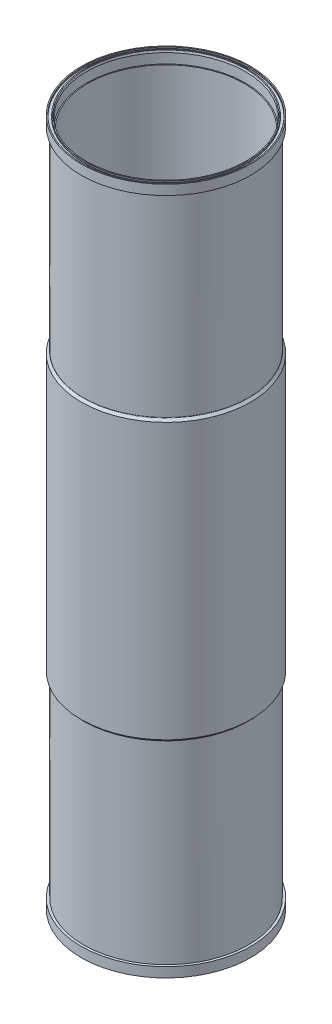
SolidWorks part; units mm, degrees
other "Static 2D"
ref_plane "Front Plane" through (0, 0, 0) normal (0, 0, 1) x (1, 0, 0)
ref_plane "Top Plane" through (0, 0, 0) normal (0, 1, 0) x (1, 0, 0)
ref_plane "Right Plane" through (0, 0, 0) normal (1, 0, 0) x (0, 0, -1)
ref_axis "Axis1" through (0, 880.11, 0) along (0, -1, 0)
sketch "Sketch1" plane through (0, 0, 0) normal (0, 0, 1) x (1, 0, 0)
  line L0 (0, 0) -> (0, 324.6281) construction
  line L1 (-109.5375, 889) -> (-103.3093, 889)
  line L2 (-102.6287, 886.46) -> (-102.6287, 873.76)
  line L3 (-109.5375, 0) -> (-103.3093, 0)
  line L4 (-101.3587, 873.76) -> (-101.3587, 15.24)
  line L5 (-109.5375, 889) -> (-109.5375, 0)
  line L6 (-102.6287, 873.76) -> (-101.3587, 873.76)
  line L7 (-102.6287, 2.54) -> (-102.6287, 15.24)
  line L8 (-102.6287, 15.24) -> (-101.3587, 15.24)
  line L9 (-103.3093, 889) -> (-102.6287, 886.46)
  line L10 (-109.5375, 0) -> (-119.5862, 0) construction
  line L11 (-103.3093, 0) -> (-102.6287, 2.54)
  dimension "D1" = 202.7174
  dimension "D2" = 219.075
  dimension "D3" = 15.24
  dimension "D4" = 15.24
  dimension "D5" = 15
  dimension "D6" = 889
  dimension "D7" = 15
  dimension "D8" = 2.54
  dimension "D9" = 2.54
  dimension "D10" = 205.2574
  dimension "D11" = 8.1788
revolve "Revolve1" add sketch "Sketch1" angle 360 about L0
sketch "Sketch4" plane through (0, 0, 0) normal (0, 0, 1) x (1, 0, 0)
  line L1 (-109.5375, 876.3) -> (-106.4387, 876.3)
  line L2 (-109.5375, 876.3) -> (-109.5375, 12.7)
  line L3 (-109.5375, 12.7) -> (-106.4387, 12.7)
  line L4 (-106.4387, 876.3) -> (-106.4387, 12.7)
  line L5 (-109.5375, 889) -> (-103.3093, 889) construction
  line L6 (-109.5375, 889) -> (-109.5375, 0) construction
  line L7 (-109.5375, 0) -> (-103.3093, 0) construction
  line L8 (-101.3587, 873.76) -> (-101.3587, 15.24) construction
  dimension "D1" = 5.08
  dimension "D2" = 12.7
  dimension "D3" = 12.7
revolve "Cut-Revolve2" cut sketch "Sketch4" angle 360 about axis through (0, 880.11, 0) along (0, -1, 0)
sketch "Sketch8" plane through (0, 0, 0) normal (0, 0, 1) x (1, 0, 0)
  line L0 (-106.4387, 876.3) -> (-106.4387, 12.7) construction
  line L1 (-109.5375, 889) -> (-109.5375, 876.3) construction
  line L2 (-109.5375, 266.7) -> (-106.6712, 263.8337)
  line L3 (-109.5375, 622.3) -> (-106.6712, 625.1663)
  line L4 (0, 12.7) -> (0, 876.3) construction
  line L5 (-106.4387, 876.3) -> (106.4387, 876.3) construction
  line L6 (109.5375, 12.7) -> (-109.5375, 12.7) construction
  line L7 (-106.4387, 625.7276) -> (-106.4387, 263.2724)
  line L9 (-109.5375, 622.3) -> (-109.5375, 266.7)
  line L13 (-106.4387, 444.5) -> (0, 444.5) construction
  arc A0 (-106.6712, 625.1663) -> (-106.4387, 625.7276) centre (-107.2324, 625.7276) ccw
  arc A1 (-106.6712, 263.8337) -> (-106.4387, 263.2724) centre (-107.2324, 263.2724) cw
  dimension "D2" = 355.6
  dimension "D4" = 0.7937
  dimension "D3" = 45
revolve "Revolve2" add sketch "Sketch8" angle 360 about L4
sketch "Sketch5" plane through (0, 0, 0) normal (0, 0, 1) x (1, 0, 0)
  line L0 (-108.2675, 889) -> (-104.4829, 889)
  line L1 (-104.6099, 888.873) -> (-104.6099, 887.2982)
  line L2 (-104.8639, 887.0442) -> (-107.8865, 887.0442)
  line L3 (-106.3752, 887.0442) -> (-106.3752, 889) construction
  line L4 (-108.1405, 888.873) -> (-108.1405, 887.2982)
  line L5 (-109.5375, 889) -> (-103.3093, 889) construction
  line L6 (0, 880.11) -> (0, -41.91) construction
  line L7 (0, 0) -> (0, 912.2666) construction
  line L8 (-109.5375, 889) -> (-109.5375, 0) construction
  arc A0 (-104.4829, 889) -> (-104.6099, 888.873) centre (-104.4829, 888.873) ccw
  arc A1 (-108.2675, 889) -> (-108.1405, 888.873) centre (-108.2675, 888.873) cw
  arc A2 (-108.1405, 887.2982) -> (-107.8865, 887.0442) centre (-107.8865, 887.2982) ccw
  arc A3 (-104.6099, 887.2982) -> (-104.8639, 887.0442) centre (-104.8639, 887.2982) cw
  point P21 (-108.1405, 887.0442)
  point P24 (-104.6099, 887.0442)
  dimension "D1" = 0.127
  dimension "D6" = 0.254
  dimension "D2" = 3.5306
  dimension "D3" = 1.9558
  dimension "D4" = 209.2198
  dimension "D5" = 1.397
revolve "2-172 O-Ring" cut sketch "Sketch5" angle 360 about L7
ref_plane "Plane1" through (0, 444.5, 0) normal (0, 1, 0) x (1, 0, 0)
mirror "Mirror1" about plane through (0, 444.5, 0) normal (0, 1, 0) of "2-172 O-Ring"
sketch "Sketch9" plane through (0, 0, 0) normal (0, 0, 1) x (1, 0, 0)
  line L0 (-109.5375, 889) -> (-109.5375, 886.46)
  line L1 (-109.5375, 889) -> (-109.5375, 876.3) construction
  line L2 (-109.5375, 886.46) -> (-102.6287, 886.46)
  line L4 (-102.6287, 886.46) -> (-102.6287, 873.76)
  line L5 (102.6287, 873.76) -> (-102.6287, 873.76) construction
  line L6 (-102.6287, 873.76) -> (0, 873.76)
  line L7 (101.3587, 873.76) -> (-101.3587, 873.76) construction
  line L8 (0, 873.76) -> (0, 889)
  line L9 (103.3093, 889) -> (-103.3093, 889) construction
  line L10 (0, 889) -> (-109.5375, 889)
  line L11 (0, 0) -> (0, 964.0449) construction
  line L13 (-102.6287, 15.24) -> (-102.6287, 2.54) construction
  line L14 (0, 0) -> (-109.5375, 0)
  line L15 (-109.5375, 0) -> (-109.5375, 12.7)
  line L16 (-109.5375, 12.7) -> (-102.6287, 12.7)
  line L17 (-102.6287, 15.24) -> (-102.6287, 12.7)
  line L20 (-102.6287, 15.24) -> (0, 15.24)
  line L21 (-102.6287, 15.24) -> (102.6287, 15.24) construction
  line L22 (0, 15.24) -> (0, 0)
revolve "Revolve3" [suppressed] add sketch "Sketch9" angle 360 about L11
